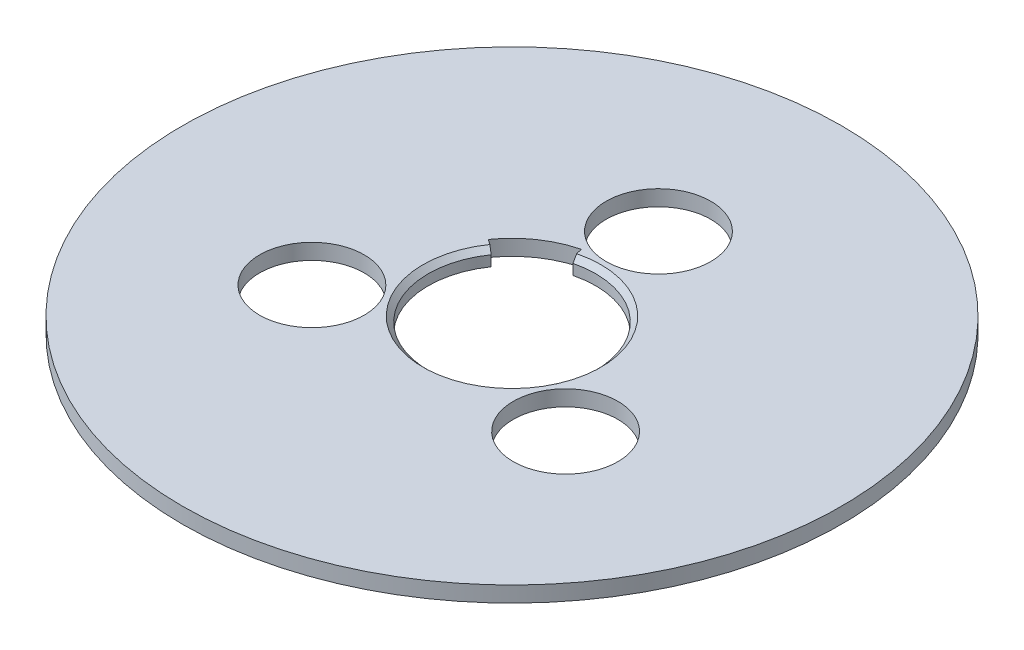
SolidWorks part; units mm, degrees
ref_plane "Front Plane" through (0, 0, 0) normal (0, 0, 1) x (1, 0, 0)
ref_plane "Top Plane" through (0, 0, 0) normal (0, 1, 0) x (1, 0, 0)
ref_plane "Right Plane" through (0, 0, 0) normal (1, 0, 0) x (0, 0, -1)
sketch "Sketch1" plane through (0, 0, 0) normal (0, 1, 0) x (1, 0, 0)
  line L0 (0, 0) -> (-1.9145, 7.7675) construction
  line L1 (-4.5406, 6.5865) -> (-7.0106, 4.8838) construction
  line L2 (-4.5406, 6.5865) -> (-2.0707, 8.2893) construction
  line L3 (0, 0) -> (-4.5406, 6.5865) construction
  line L4 (-1.9388, 7.7615) -> (-2.0707, 8.2893)
  line L5 (-2.0707, 8.2893) -> (-2.2054, 8.8287)
  line L6 (-6.5642, 4.5729) -> (-7.0106, 4.8838)
  line L7 (-7.0106, 4.8838) -> (-7.4668, 5.2016)
  circle A0 centre (0, 0) radius 31.5
  arc A1 (-6.5642, 4.5729) -> (-1.9388, 7.7615) centre (0, 0) ccw
  circle A2 centre (0, 0) radius 14 construction
  circle A3 centre (0, 0) radius 20 construction
  circle A4 centre (0, 0) radius 26 construction
  arc A5 (-2.2054, 8.8287) -> (-7.4668, 5.2016) centre (0, 0) ccw
extrude "Boss-Extrude1" add sketch "Sketch1" against normal blind 1.5
chamfer "Chamfer1" distance 0.5 angle 45 1 edges at (4.5406, 0, 6.5865)
sketch "Sketch2" plane through (0, 0, 0) normal (0, 1, 0) x (1, 0, 0)
  circle A0 centre (0, 14) radius 5
  circle A1 centre (0, 0) radius 14 construction
  circle A2 centre (12.1244, -7) radius 5
  circle A3 centre (-12.1244, -7) radius 5
  point P10 (0, 0)
  dimension "D1" = 3
  dimension "D3" = 10
  dimension "D5" = 10
  dimension "D2" = 14
  dimension "D4" = 14
extrude "Cut-Extrude1" cut sketch "Sketch2" against normal through all
chamfer "Chamfer2" [suppressed] distance 0.5 angle 45
